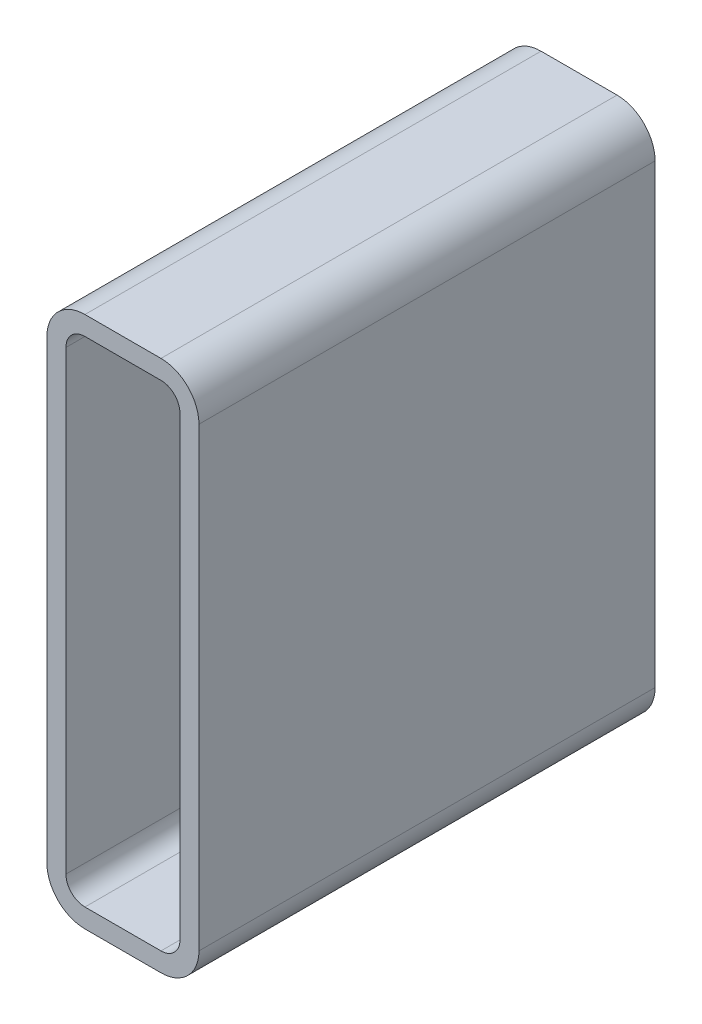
SolidWorks part; units mm, degrees
ref_plane "Front Plane" through (0, 0, 0) normal (0, 0, 1) x (1, 0, 0)
ref_plane "Top Plane" through (0, 0, 0) normal (0, 1, 0) x (1, 0, 0)
ref_plane "Right Plane" through (0, 0, 0) normal (1, 0, 0) x (0, 0, -1)
sketch "Sketch1" plane through (0, 0, 0) normal (0, 0, 1) x (1, 0, 0)
sketch_block_instance "HSS14x4x0.500-1"
sketch_block "HSS14x4x0.500"
extrude "Boss-Extrude1" add sketch "Sketch1" along normal blind 304.8
